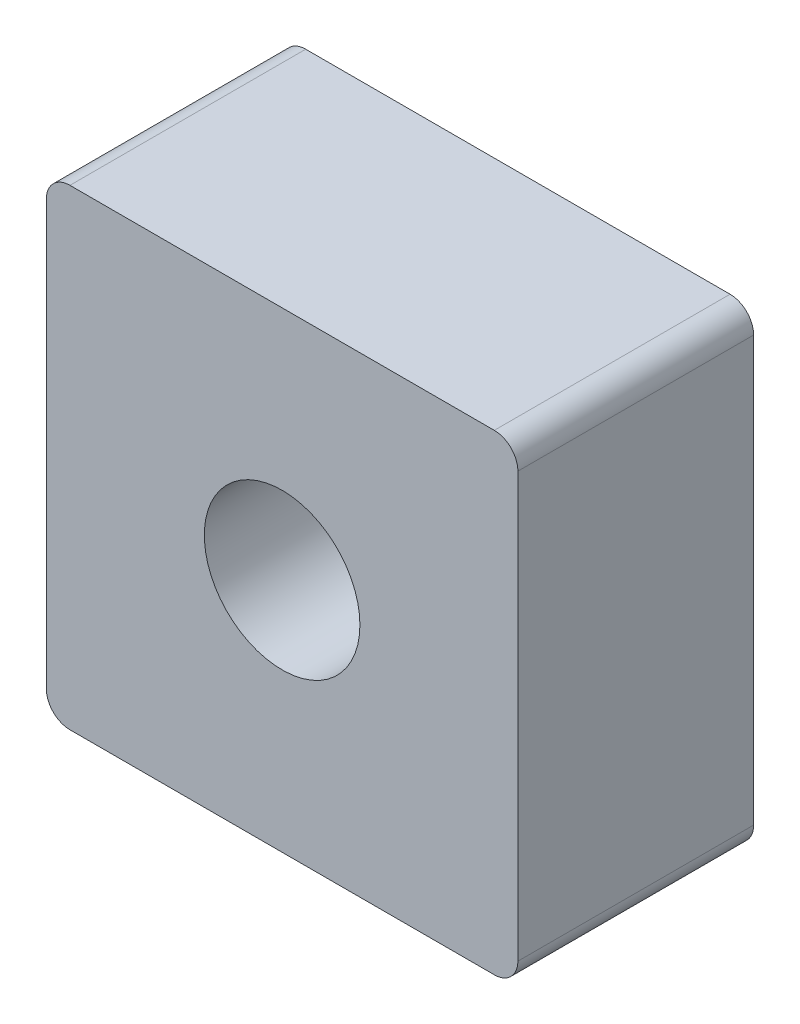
SolidWorks part; units mm, degrees
ref_plane "正面" through (0, 0, 0) normal (0, 0, 1) x (1, 0, 0)
ref_plane "平面" through (0, 0, 0) normal (0, 1, 0) x (1, 0, 0)
ref_plane "右側面" through (0, 0, 0) normal (1, 0, 0) x (0, 0, -1)
sketch "ｽｹｯﾁ1" plane through (0, 0, 0) normal (0, 0, 1) x (1, 0, 0)
  line L1 (-5, 5) -> (5, 5)
  line L2 (-5, 5) -> (-5, -5)
  line L3 (-5, -5) -> (5, -5)
  line L4 (5, 5) -> (5, -5)
  dimension "D1" = 5
  dimension "D2" = 10
  dimension "D3" = 5
  dimension "D4" = 10
extrude "押し出し1" add sketch "ｽｹｯﾁ1" along normal mid plane 5
hole_wizard "M4x0.7 ねじ穴1" positions "3Dｽｹｯﾁ1" profile "ｽｹｯﾁ3" tap size "M4x0.7" standard "JIS"
sketch3d "3Dｽｹｯﾁ1"
  line L0 (-5, 5, 2.5) -> (-5, -5, 2.5) construction
  line L1 (-5, -5, 2.5) -> (5, -5, 2.5) construction
  point P0 (0, 0, 2.5)
  dimension "D1" = 5
  dimension "D2" = 5
sketch "ｽｹｯﾁ3" plane through (0, 0, 2.5) normal (1, 0, 0) x (0, -1, 0)
  line L0 (0, 0) -> (0, 5)
  line L1 (0, 5) -> (1.65, 5)
  line L2 (1.65, 5) -> (1.65, 0)
  line L5 (1.65, 0) -> (0, 0)
  line L11 (0, -6.35) -> (0, 107.95) construction
  dimension "次ｻｰﾌｪｽまでのねじ下穴ﾄﾞﾘﾙの直径" = 3.3
  dimension "次ｻｰﾌｪｽまでのねじ下穴ﾄﾞﾘﾙの深さ" = 5
fillet "ﾌｨﾚｯﾄ1" radius 0.5 4 edges at (-5, 5, 0) (-5, -5, 0) (5, -5, 0) (5, 5, 0)
